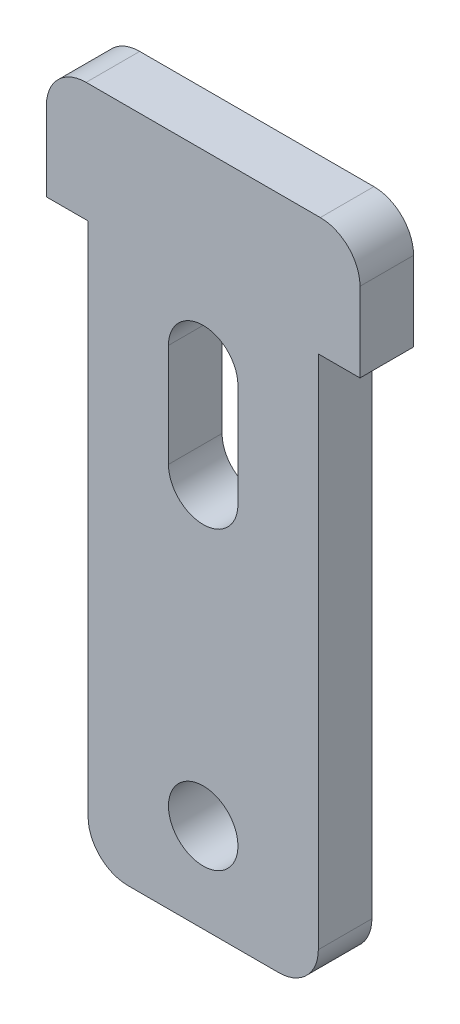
SolidWorks part; units mm, degrees
ref_plane "Plan de face" through (0, 0, 0) normal (0, 0, 1) x (1, 0, 0)
ref_plane "Plan de dessus" through (0, 0, 0) normal (0, 1, 0) x (1, 0, 0)
ref_plane "Plan de droite" through (0, 0, 0) normal (1, 0, 0) x (0, 0, -1)
sketch "Esquisse2" plane through (0, 0, 0) normal (0, 0, 1) x (1, 0, 0)
  line L0 (13.2739, 0) -> (-7.8628, 0) construction
  line L1 (0, 16.2657) -> (0, -11.7535) construction
  line L2 (-7.9, 0) -> (-5.8, 0)
  line L3 (-7.9, 0) -> (-7.9, 4)
  line L4 (-5.9, 6) -> (5.9, 6)
  line L5 (7.9, 0) -> (7.9, 4)
  line L7 (-5.8, 0) -> (-5.8, -26)
  line L8 (-3.8, -28) -> (3.8, -28)
  line L9 (5.8, -26) -> (5.8, 0)
  line L10 (5.8, 0) -> (7.9, 0)
  line L11 (0, -23.5) -> (-19.0002, -23.5) construction
  line L12 (17.4132, -6) -> (-22.8984, -6) construction
  line L13 (0, -3.4029) -> (0, -8.5971) construction
  line L14 (1.75, -3.4029) -> (1.75, -8.5971)
  line L15 (-1.75, -3.4029) -> (-1.75, -8.5971)
  circle A0 centre (0, -23.5) radius 1.75
  arc A1 (1.75, -3.4029) -> (-1.75, -3.4029) centre (0, -3.4029) ccw
  arc A2 (-1.75, -8.5971) -> (1.75, -8.5971) centre (0, -8.5971) ccw
  arc A3 (-5.8, -26) -> (-3.8, -28) centre (-3.8, -26) ccw
  arc A4 (3.8, -28) -> (5.8, -26) centre (3.8, -26) ccw
  arc A5 (5.9, 6) -> (7.9, 4) centre (5.9, 4) cw
  arc A6 (-7.9, 4) -> (-5.9, 6) centre (-5.9, 4) cw
  point P3 (-7.9, 2)
  point P8 (0, 0)
  point P23 (0, -6)
  dimension "D6" = 17.5
  dimension "D7" = 2
  dimension "D1" = 15.8
  dimension "D2" = 11.6
  dimension "D3" = 6
  dimension "D4" = 28
  dimension "D5" = 4.5
extrude "Boss.-Extru.1" add sketch "Esquisse2" along normal blind 2.7
